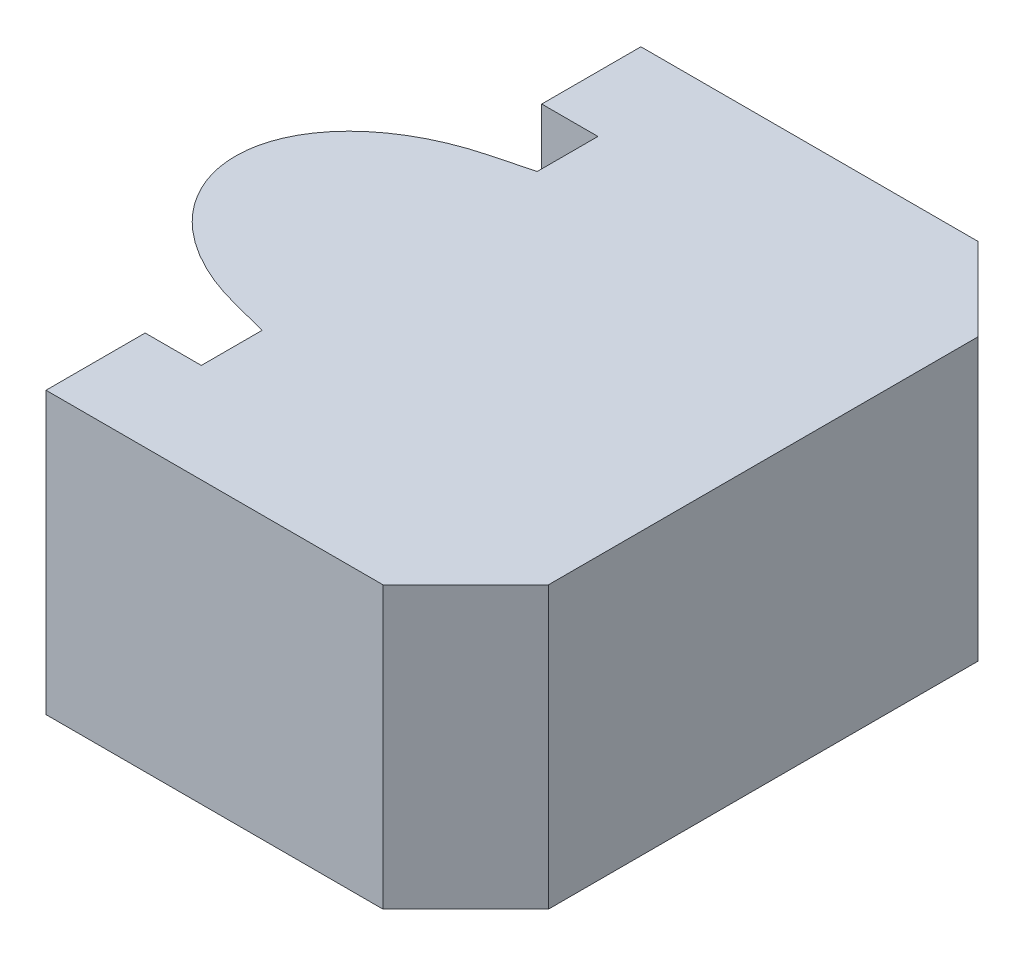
SolidWorks part; units mm, degrees
ref_plane "Vorne" through (0, 0, 0) normal (0, 0, 1) x (1, 0, 0)
ref_plane "Oben" through (0, 0, 0) normal (0, 1, 0) x (1, 0, 0)
ref_plane "Rechts" through (0, 0, 0) normal (1, 0, 0) x (0, 0, -1)
sketch "Skizze1" plane through (0, 0, 0) normal (0, 1, 0) x (1, 0, 0)
  line L1 (-44.6813, 23.83) -> (41.1068, 23.83)
  line L2 (-44.6813, 23.83) -> (-44.6813, -33.362)
  line L3 (-44.6813, -33.362) -> (41.1068, -33.362)
  line L4 (41.1068, 23.83) -> (41.1068, -33.362)
extrude "Linear austragen1" add sketch "Skizze1" along normal blind 12.5
sketch "Skizze2" plane through (0, 0, 0) normal (0, -1, 0) x (1, 0, 0)
  line L0 (-26.3604, 10.766) -> (-21.6604, 10.766)
  line L1 (-26.3604, 13.766) -> (-13.6604, 13.766)
  line L3 (-26.3604, -4.234) -> (-13.6604, -4.234)
  line L4 (-13.6604, 13.766) -> (-13.6604, -4.234)
  line L5 (-21.6604, 10.766) -> (-21.6604, -1.234)
  line L6 (-21.6604, -1.234) -> (-26.3604, -1.234)
  line L8 (-21.6604, 4.766) -> (-44.6813, 4.766) construction
  line L9 (-44.6813, -23.83) -> (-44.6813, 33.362) construction
  line L10 (-26.3604, -4.234) -> (-26.3604, -1.234)
  line L11 (-26.3604, 13.766) -> (-26.3604, 10.766)
  dimension "D1" = 18
  dimension "D2" = 3
  dimension "D3" = 3
  dimension "D6" = 8
extrude "Linear austragen2" add sketch "Skizze2" along normal blind 8.5
fillet "Verrundung1" radius 3 1 edges at (-21.6604, 0, 4.766)
ref_plane "Ebene1" through (0, 0, 4.766) normal (0, 0, -1) x (-1, 0, 0)
sketch "Skizze3" plane through (0, 0, 4.766) normal (0, 0, -1) x (-1, 0, 0)
  line L0 (19.6604, -6.5) -> (22.6604, -3.5)
  line L1 (26.3604, -8.5) -> (13.6604, -8.5) construction
  line L3 (13.6604, -8.5) -> (26.3604, -8.5) construction
  line L4 (13.6604, -8.5) -> (13.6604, 0) construction
  line L5 (26.3604, -8.5) -> (13.6604, -8.5) construction
  dimension "D1" = 45
  dimension "D2" = 2
  dimension "D3" = 9
  dimension "D4" = 5
ref_plane "Ebene2" through (-19.6604, -6.5, 4.766) normal (-0.7071, 0.7071, 0) x (0, 0, 1)
sketch "Skizze4" plane through (-19.6604, -6.5, 4.766) normal (-0.7071, 0.7071, 0) x (0, 0, 1)
  line L0 (0, -2.8284) -> (0, 4.5067) construction
  line L1 (-1.8839, -0.5291) -> (-3, 2.4716)
  line L2 (1.8839, -0.5291) -> (3, 2.4716)
  line L3 (-3, 2.4716) -> (3, 2.4716)
  line L5 (6, -2.8284) -> (-6, -2.8284) construction
  arc A0 (1.8839, -0.5291) -> (-1.8839, -0.5291) centre (0, 0.1716) cw
  point P8 (0, 2.4716)
  dimension "D4" = 2.01
  dimension "D1" = 6
  dimension "D2" = 5.3
  dimension "D3" = 3
extrude "Linear austragen3" add sketch "Skizze4" along normal blind 20
chamfer "Fase1" distance 2.5 angle 45 2 edges at (-13.6604, -4.25, -4.234) (-13.6604, -4.25, 13.766)
fillet "Verrundung2" radius 2.1 8 edges at (-22.5391, -0.8787, 1.964) (-22.5391, -0.8787, 7.568) (-21.6604, -7.0999, 4.766) (-28.7603, 0, 4.766) (-25.7845, 0, 6.9456) (-21.6604, -4.1242, 6.9456) (-25.7845, 0, 2.5864) (-21.6604, -4.1242, 2.5864)
sketch "Skizze5" plane through (0, 0, -23.83) normal (0, 0, -1) x (-1, 0, 0)
  line L4 (-41.1068, 0) -> (44.6813, 0)
  line L5 (44.6813, 0) -> (44.6813, 12.5)
  line L6 (44.6813, 12.5) -> (-41.1068, 12.5)
  line L7 (-41.1068, 12.5) -> (-41.1068, 0)
  line L8 (-41.1068, 0) -> (44.6813, 0)
  line L9 (44.6813, 0) -> (44.6813, 12.5)
  line L10 (44.6813, 12.5) -> (-41.1068, 12.5)
  line L11 (-41.1068, 12.5) -> (-41.1068, 0)
  dimension "D1" = 0
extrude "Schnitt-Linear austragen1" cut sketch "Skizze5" against normal up to surface (57.1921 mm away)
sketch "Skizze6" plane through (0, 0, 0) normal (0, 1, 0) x (-1, 0, 0)
  line L12 (26.3604, -1.234) -> (24.6604, -1.234)
  line L13 (24.6604, -1.234) -> (24.6604, 0.6025)
  line L15 (24.6604, 0.6025) -> (25.844, 0.9138)
  line L16 (24.6604, 0.6025) -> (25.844, 0.9138)
  line L17 (24.6604, 10.766) -> (26.3604, 10.766)
  line L18 (25.844, 8.6182) -> (24.6604, 8.9295)
  line L19 (26.3604, 13.766) -> (16.1604, 13.766)
  line L20 (13.6604, 11.266) -> (13.6604, -1.734)
  line L21 (16.1604, -4.234) -> (26.3604, -4.234)
  line L22 (26.3604, -4.234) -> (26.3604, -1.234)
  line L23 (26.3604, -1.234) -> (24.6604, -1.234)
  line L24 (24.6604, -1.234) -> (24.6604, 0.6025)
  line L25 (25.844, 8.6182) -> (24.6604, 8.9295)
  line L26 (24.6604, 8.9295) -> (24.6604, 10.766)
  line L27 (24.6604, 8.9295) -> (24.6604, 10.766)
  line L28 (24.6604, 10.766) -> (26.3604, 10.766)
  line L29 (26.3604, -4.234) -> (26.3604, -1.234)
  line L30 (26.3604, 13.766) -> (16.1604, 13.766)
  line L31 (13.6604, 11.266) -> (13.6604, -1.734)
  line L32 (16.1604, -4.234) -> (26.3604, -4.234)
  line L33 (26.3604, 10.766) -> (26.3604, 13.766)
  line L34 (26.3604, 10.766) -> (26.3604, 13.766)
  line L35 (16.1604, 13.766) -> (13.6604, 11.266)
  line L36 (16.1604, 13.766) -> (13.6604, 11.266)
  line L37 (13.6604, -1.734) -> (16.1604, -4.234)
  line L38 (13.6604, -1.734) -> (16.1604, -4.234)
  ellipse E1 centre (23.8177, 4.766) end of major axis (18.0053, 4.766) minor radius 4.11 (25.844, 0.9138) -> (25.844, 8.6182) ccw
  ellipse E2 centre (23.8177, 4.766) end of major axis (18.0053, 4.766) minor radius 4.11 (25.844, 0.9138) -> (25.844, 8.6182) ccw
  dimension "D1" = 0
